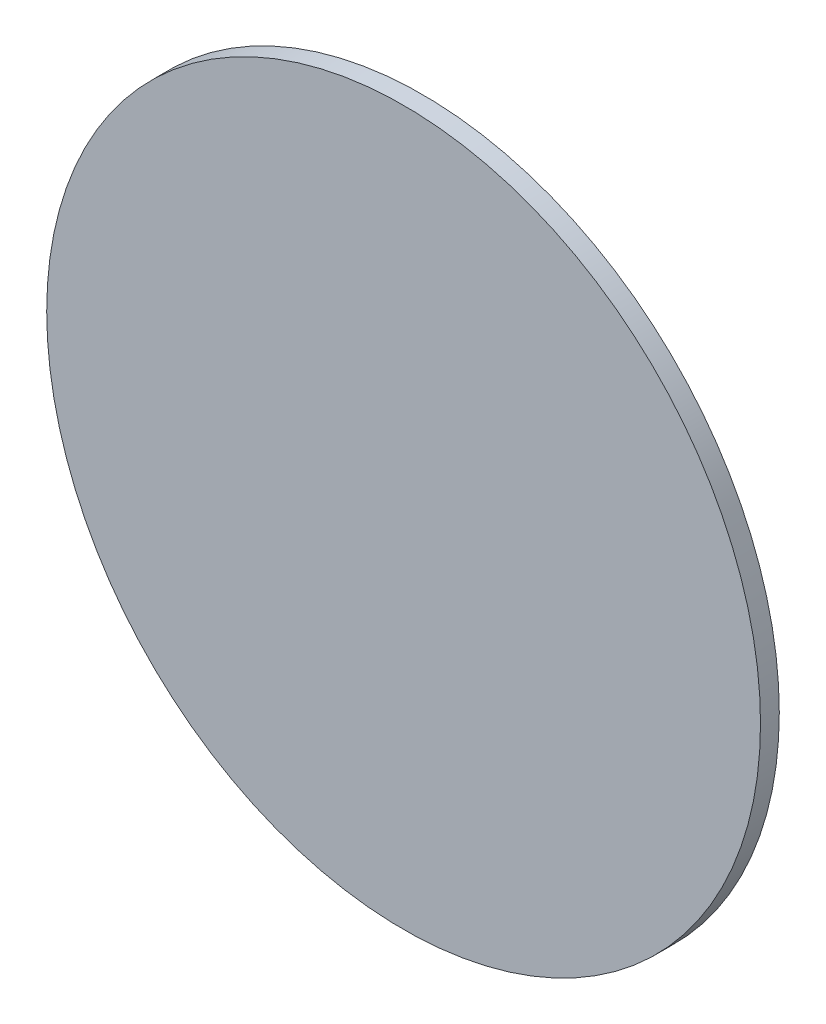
SolidWorks part; units mm, degrees
ref_plane "Alzado" through (0, 0, 0) normal (0, 0, 1) x (1, 0, 0)
ref_plane "Planta" through (0, 0, 0) normal (0, 1, 0) x (1, 0, 0)
ref_plane "Vista lateral" through (0, 0, 0) normal (1, 0, 0) x (0, 0, -1)
sketch "Croquis1" plane through (0, 0, 0) normal (0, 0, 1) x (1, 0, 0)
  circle A0 centre (0, 0) radius 19
  dimension "D1" = 38
extrude "Saliente-Extruir1" add sketch "Croquis1" along normal blind 1
